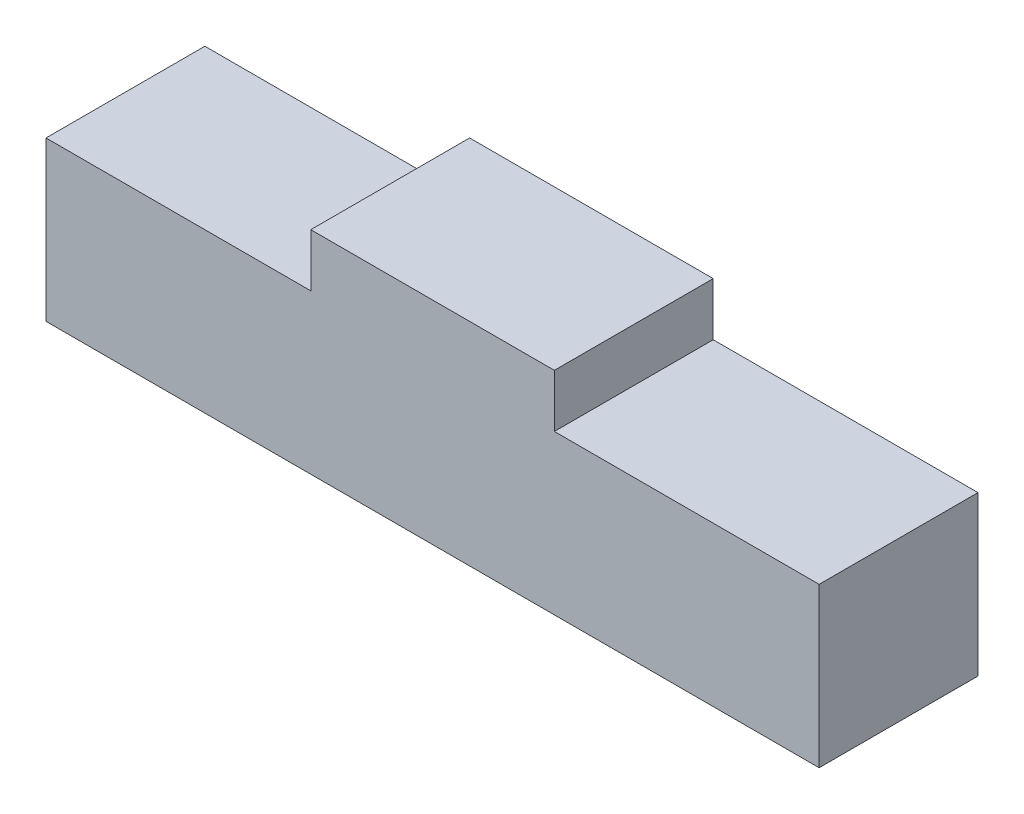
SolidWorks part; units mm, degrees
ref_plane "Plan de face" through (0, 0, 0) normal (0, 0, 1) x (1, 0, 0)
ref_plane "Plan de dessus" through (0, 0, 0) normal (0, 1, 0) x (1, 0, 0)
ref_plane "Plan de droite" through (0, 0, 0) normal (1, 0, 0) x (0, 0, -1)
sketch "Esquisse1" plane through (0, 0, 0) normal (0, 0, 1) x (1, 0, 0)
  line L0 (0, 0) -> (-7.3, 0)
  line L1 (-7.3, 0) -> (-7.3, 3)
  line L2 (-7.3, 3) -> (-2.3, 3)
  line L3 (-2.3, 3) -> (-2.3, 4)
  line L4 (-2.3, 4) -> (0, 4)
  line L5 (0, 4) -> (0, 0)
  dimension "D1" = 2.3
  dimension "D2" = 7.3
  dimension "D3" = 3
  dimension "D4" = 4
extrude "Extrusion1" add sketch "Esquisse1" along normal blind 3
mirror "Symétrie1" about plane through (0, 4, 3) normal (-1, 0, 0)
